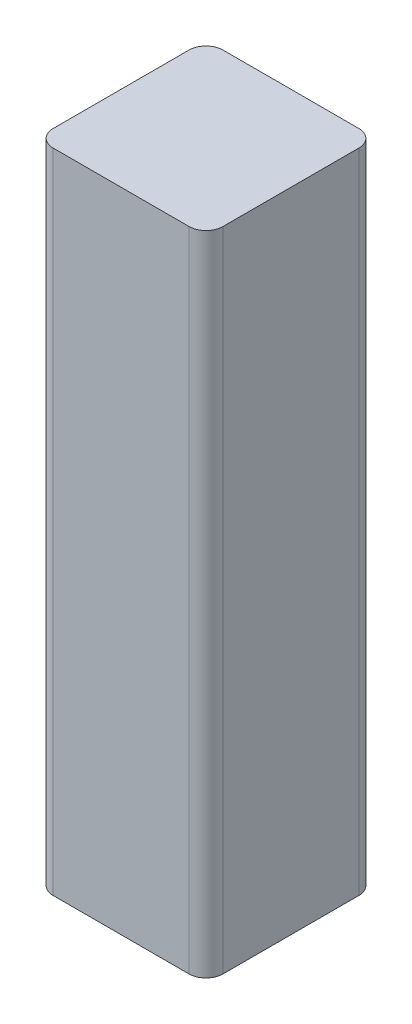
SolidWorks part; units mm, degrees
ref_plane "Plan de face" through (0, 0, 0) normal (0, 0, 1) x (1, 0, 0)
ref_plane "Plan de dessus" through (0, 0, 0) normal (0, 1, 0) x (1, 0, 0)
ref_plane "Plan de droite" through (0, 0, 0) normal (1, 0, 0) x (0, 0, -1)
sketch "Esquisse1" plane through (0, 0, 0) normal (0, 1, 0) x (1, 0, 0)
  line L1 (-40, -40) -> (40, -40)
  line L2 (-40, -40) -> (-40, 40)
  line L3 (-40, 40) -> (40, 40)
  line L4 (40, -40) -> (40, 40)
  line L5 (-40, -40) -> (40, 40) construction
  line L6 (-40, 40) -> (40, -40) construction
  point P0 (0, 0)
  dimension "D1" = 80
extrude "Boss.-Extru.1" add sketch "Esquisse1" along normal blind 305
fillet "Congé1" radius 8 4 edges at (-40, 152.5, -40) (40, 152.5, -40) (-40, 152.5, 40) (40, 152.5, 40)
